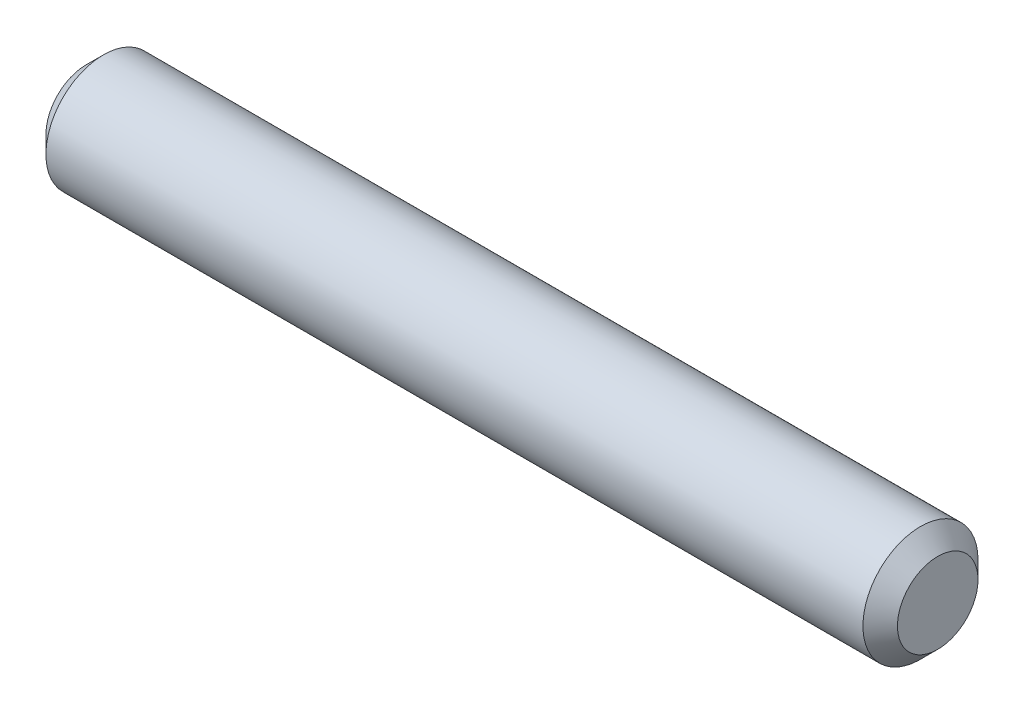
SolidWorks part; units mm, degrees
ref_plane "Front Plane" through (0, 0, 0) normal (0, 0, 1) x (1, 0, 0)
ref_plane "Top Plane" through (0, 0, 0) normal (0, 1, 0) x (1, 0, 0)
ref_plane "Right Plane" through (0, 0, 0) normal (1, 0, 0) x (0, 0, -1)
sketch "Sketch1" plane through (0, 0, 0) normal (0, 0, 1) x (1, 0, 0)
  line L0 (-7.4, 0.7) -> (-7.4, 0)
  line L1 (-7.4, 0) -> (7.4, 0)
  line L2 (7.4, 0) -> (7.4, 0.7)
  line L3 (7.4, 0.7) -> (7.1, 1)
  line L4 (7.1, 1) -> (-7.1, 1)
  line L5 (-7.1, 1) -> (-7.4, 0.7)
  line L6 (-7.4, 0) -> (7.4, 0) construction
revolve "Revolve1" add sketch "Sketch1" angle 360 about L6
